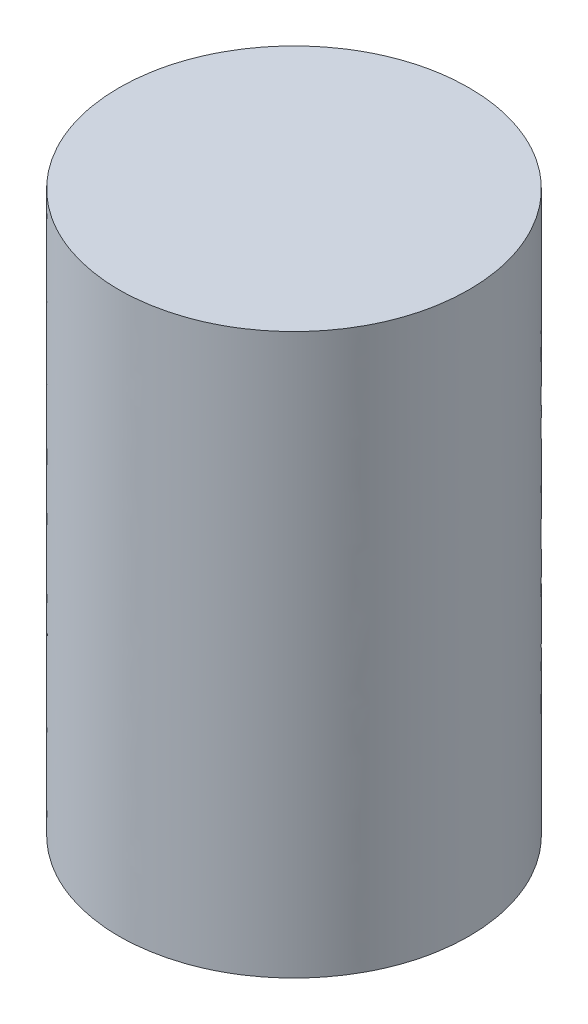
SolidWorks part; units mm, degrees
ref_plane "正面" through (0, 0, 0) normal (0, 0, 1) x (1, 0, 0)
ref_plane "平面" through (0, 0, 0) normal (0, 1, 0) x (1, 0, 0)
ref_plane "右側面" through (0, 0, 0) normal (1, 0, 0) x (0, 0, -1)
sketch "ｽｹｯﾁ1" plane through (0, 0, 0) normal (0, 1, 0) x (1, 0, 0)
  circle A0 centre (0, 0) radius 25
  dimension "D1" = 50
ref_plane "平面1" through (0, 80, 0) normal (0, 1, 0) x (-1, 0, 0)
sketch "ｽｹｯﾁ2" plane through (0, 80, 0) normal (0, 1, 0) x (-1, 0, 0)
  circle A0 centre (0, 0) radius 25 construction
  circle A1 centre (0, 0) radius 25
sketch "ｽｹｯﾁ3" plane through (0, 0, 0) normal (1, 0, 0) x (0, 0, -1)
  line L0 (25, 80) -> (25, 0)
loft "ﾛﾌﾄ1" add profiles "ｽｹｯﾁ2", "ｽｹｯﾁ1"
